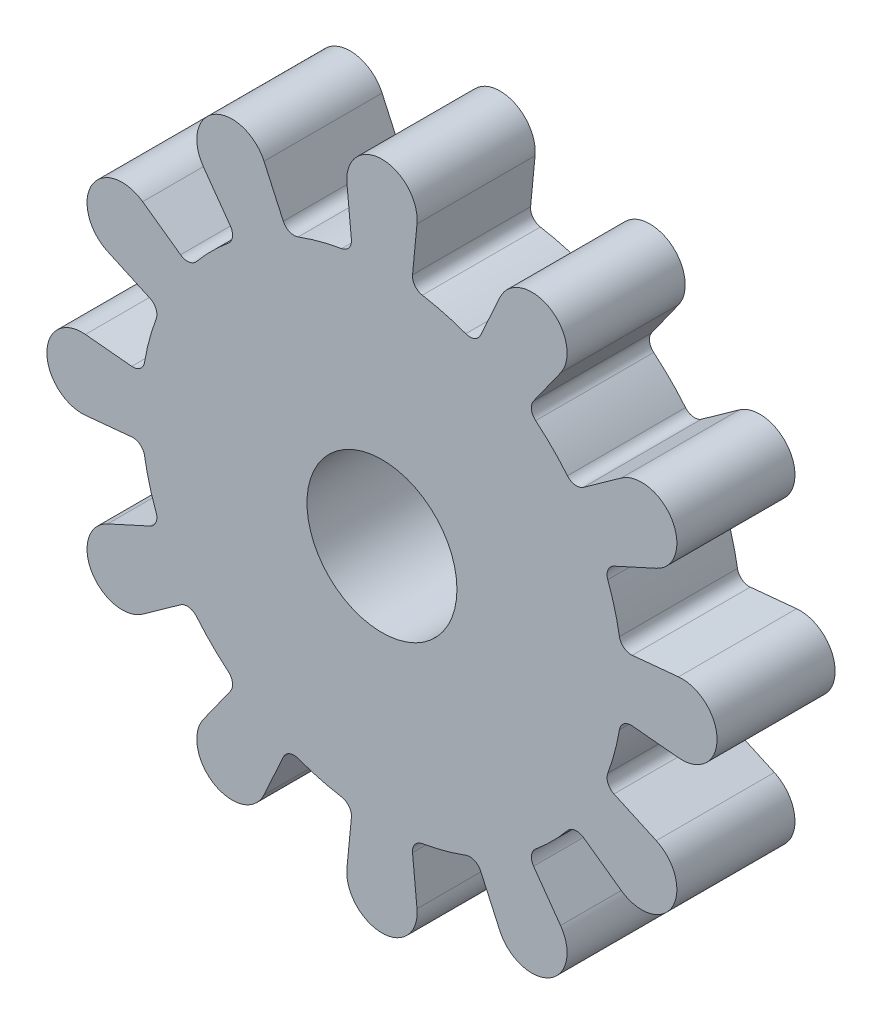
SolidWorks part; units mm, degrees
ref_plane "Спереди" through (0, 0, 0) normal (0, 0, 1) x (1, 0, 0)
ref_plane "Сверху" through (0, 0, 0) normal (0, 1, 0) x (1, 0, 0)
ref_plane "Справа" through (0, 0, 0) normal (1, 0, 0) x (0, 0, -1)
sketch "Эскиз1" plane through (0, 0, 0) normal (0, 0, 1) x (1, 0, 0)
  line L0 (0, 40.9171) -> (0, -45.5367) construction
  line L1 (-2.5887, 21.1936) -> (-2.9663, 25.1144)
  line L2 (2.5887, 21.1936) -> (2.9663, 25.1144)
  line L3 (8.3549, 19.6485) -> (9.9883, 23.2328)
  line L4 (12.8387, 17.0598) -> (15.1261, 20.2666)
  line L5 (17.0598, 12.8387) -> (20.2666, 15.1261)
  line L6 (19.6485, 8.3549) -> (23.2328, 9.9883)
  line L7 (21.1936, 2.5887) -> (25.1144, 2.9663)
  line L8 (21.1936, -2.5887) -> (25.1144, -2.9663)
  line L9 (19.6485, -8.3549) -> (23.2328, -9.9883)
  line L10 (17.0598, -12.8387) -> (20.2666, -15.1261)
  line L11 (12.8387, -17.0598) -> (15.1261, -20.2666)
  line L12 (8.3549, -19.6485) -> (9.9883, -23.2328)
  line L13 (2.5887, -21.1936) -> (2.9663, -25.1144)
  line L14 (-2.5887, -21.1936) -> (-2.9663, -25.1144)
  line L15 (-8.3549, -19.6485) -> (-9.9883, -23.2328)
  line L16 (-12.8387, -17.0598) -> (-15.1261, -20.2666)
  line L17 (-17.0598, -12.8387) -> (-20.2666, -15.1261)
  line L18 (-19.6485, -8.3549) -> (-23.2328, -9.9883)
  line L19 (-21.1936, -2.5887) -> (-25.1144, -2.9663)
  line L20 (-21.1936, 2.5887) -> (-25.1144, 2.9663)
  line L21 (-19.6485, 8.3549) -> (-23.2328, 9.9883)
  line L22 (-17.0598, 12.8387) -> (-20.2666, 15.1261)
  line L23 (-12.8387, 17.0598) -> (-15.1261, 20.2666)
  line L24 (-8.3549, 19.6485) -> (-9.9883, 23.2328)
  circle A0 centre (0, 0) radius 6.35
  circle A1 centre (0, 0) radius 25.4 construction
  arc A2 (2.9663, 25.1144) -> (-2.9663, 25.1144) centre (0, 25.4) ccw
  arc A3 (-3.4167, 20.1118) -> (-7.097, 19.1257) centre (0, 0) ccw
  arc A4 (15.1261, 20.2666) -> (9.9883, 23.2328) centre (12.7, 21.997) ccw
  arc A5 (23.2328, 9.9883) -> (20.2666, 15.1261) centre (21.997, 12.7) ccw
  arc A6 (25.1144, -2.9663) -> (25.1144, 2.9663) centre (25.4, 0) ccw
  arc A7 (20.2666, -15.1261) -> (23.2328, -9.9883) centre (21.997, -12.7) ccw
  arc A8 (9.9883, -23.2328) -> (15.1261, -20.2666) centre (12.7, -21.997) ccw
  arc A9 (-2.9663, -25.1144) -> (2.9663, -25.1144) centre (0, -25.4) ccw
  arc A10 (-15.1261, -20.2666) -> (-9.9883, -23.2328) centre (-12.7, -21.997) ccw
  arc A11 (-23.2328, -9.9883) -> (-20.2666, -15.1261) centre (-21.997, -12.7) ccw
  arc A12 (-25.1144, 2.9663) -> (-25.1144, -2.9663) centre (-25.4, 0) ccw
  arc A13 (-20.2666, 15.1261) -> (-23.2328, 9.9883) centre (-21.997, 12.7) ccw
  arc A14 (-9.9883, 23.2328) -> (-15.1261, 20.2666) centre (-12.7, 21.997) ccw
  arc A15 (-13.0148, 15.709) -> (-15.709, 13.0148) centre (0, 0) ccw
  arc A16 (7.097, 19.1257) -> (3.4167, 20.1118) centre (0, 0) ccw
  arc A17 (15.709, 13.0148) -> (13.0148, 15.709) centre (0, 0) ccw
  arc A18 (20.1118, 3.4167) -> (19.1257, 7.097) centre (0, 0) ccw
  arc A19 (19.1257, -7.097) -> (20.1118, -3.4167) centre (0, 0) ccw
  arc A20 (13.0148, -15.709) -> (15.709, -13.0148) centre (0, 0) ccw
  arc A21 (-19.1257, 7.097) -> (-20.1118, 3.4167) centre (0, 0) ccw
  arc A22 (-20.1118, -3.4167) -> (-19.1257, -7.097) centre (0, 0) ccw
  arc A23 (-15.709, -13.0148) -> (-13.0148, -15.709) centre (0, 0) ccw
  arc A24 (-7.097, -19.1257) -> (-3.4167, -20.1118) centre (0, 0) ccw
  arc A25 (3.4167, -20.1118) -> (7.097, -19.1257) centre (0, 0) ccw
  arc A26 (-21.1936, -2.5887) -> (-20.1118, -3.4167) centre (-21.0977, -3.5841) cw
  arc A27 (-19.6485, -8.3549) -> (-19.1257, -7.097) centre (-20.0632, -7.4449) ccw
  arc A28 (-17.0598, -12.8387) -> (-15.709, -13.0148) centre (-16.4791, -13.6528) cw
  arc A29 (-12.8387, -17.0598) -> (-13.0148, -15.709) centre (-13.6528, -16.4791) ccw
  arc A30 (-8.3549, -19.6485) -> (-7.097, -19.1257) centre (-7.4449, -20.0632) cw
  arc A31 (-2.5887, -21.1936) -> (-3.4167, -20.1118) centre (-3.5841, -21.0977) ccw
  arc A32 (2.5887, -21.1936) -> (3.4167, -20.1118) centre (3.5841, -21.0977) cw
  arc A33 (8.3549, -19.6485) -> (7.097, -19.1257) centre (7.4449, -20.0632) ccw
  arc A34 (12.8387, -17.0598) -> (13.0148, -15.709) centre (13.6528, -16.4791) cw
  arc A35 (17.0598, -12.8387) -> (15.709, -13.0148) centre (16.4791, -13.6528) ccw
  arc A36 (19.6485, -8.3549) -> (19.1257, -7.097) centre (20.0632, -7.4449) cw
  arc A37 (21.1936, -2.5887) -> (20.1118, -3.4167) centre (21.0977, -3.5841) ccw
  arc A38 (21.1936, 2.5887) -> (20.1118, 3.4167) centre (21.0977, 3.5841) cw
  arc A39 (19.6485, 8.3549) -> (19.1257, 7.097) centre (20.0632, 7.4449) ccw
  arc A40 (17.0598, 12.8387) -> (15.709, 13.0148) centre (16.4791, 13.6528) cw
  arc A41 (12.8387, 17.0598) -> (13.0148, 15.709) centre (13.6528, 16.4791) ccw
  arc A42 (8.3549, 19.6485) -> (7.097, 19.1257) centre (7.4449, 20.0632) cw
  arc A43 (2.5887, 21.1936) -> (3.4167, 20.1118) centre (3.5841, 21.0977) ccw
  arc A44 (-21.1936, 2.5887) -> (-20.1118, 3.4167) centre (-21.0977, 3.5841) ccw
  arc A45 (-19.6485, 8.3549) -> (-19.1257, 7.097) centre (-20.0632, 7.4449) cw
  arc A46 (-17.0598, 12.8387) -> (-15.709, 13.0148) centre (-16.4791, 13.6528) ccw
  arc A47 (-12.8387, 17.0598) -> (-13.0148, 15.709) centre (-13.6528, 16.4791) cw
  arc A48 (-8.3549, 19.6485) -> (-7.097, 19.1257) centre (-7.4449, 20.0632) ccw
  arc A49 (-2.5887, 21.1936) -> (-3.4167, 20.1118) centre (-3.5841, 21.0977) cw
  point P102 (2.4976, 20.2465)
  point P115 (-2.4976, 20.2465)
  dimension "D1" = 12.7
  dimension "D2" = 50.8
  dimension "D3" = 5.96
  dimension "D5" = 40.8
  dimension "D7" = 1
  dimension "D4" = 5.5
  dimension "D6" = 12
extrude "Бобышка-Вытянуть1" add sketch "Эскиз1" along normal blind 10
